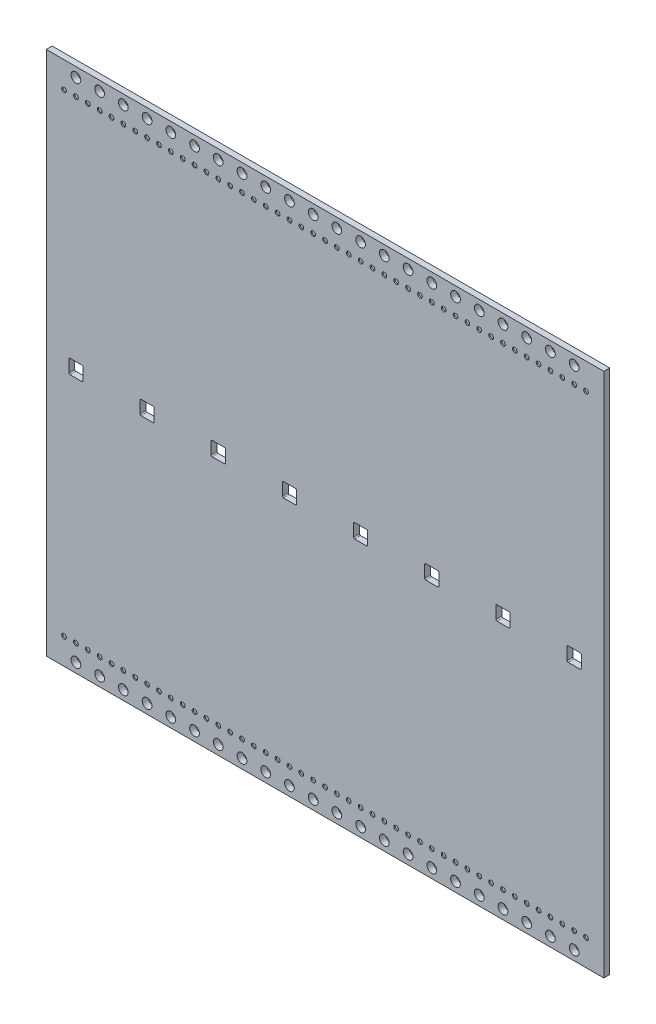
SolidWorks part; units mm, degrees
ref_plane "前视基准面" through (0, 0, 0) normal (0, 0, 1) x (1, 0, 0)
ref_plane "上视基准面" through (0, 0, 0) normal (0, 1, 0) x (1, 0, 0)
ref_plane "右视基准面" through (0, 0, 0) normal (1, 0, 0) x (0, 0, -1)
sketch "草图1" plane through (0, 0, 0) normal (0, 0, 1) x (1, 0, 0)
  line L0 (-117.5, 110.725) -> (117.5, 110.725)
  line L1 (117.5, -110.725) -> (-117.5, -110.725)
  line L2 (-117.5, -110.725) -> (-117.5, 110.725)
  line L3 (117.5, 110.725) -> (117.5, -110.725)
  line L4 (117.5, 110.725) -> (-117.5, -110.725) construction
  circle A0 centre (-105, 106.725) radius 2.05
  circle A1 centre (-95, 106.725) radius 2.05
  circle A2 centre (-95, -106.725) radius 2.05
  circle A3 centre (-85, 106.725) radius 2.05
  circle A4 centre (-85, -106.725) radius 2.05
  circle A5 centre (-75, 106.725) radius 2.05
  circle A6 centre (-75, -106.725) radius 2.05
  circle A7 centre (-65, 106.725) radius 2.05
  circle A8 centre (-65, -106.725) radius 2.05
  circle A9 centre (-55, 106.725) radius 2.05
  circle A10 centre (-55, -106.725) radius 2.05
  circle A11 centre (-45, 106.725) radius 2.05
  circle A12 centre (-45, -106.725) radius 2.05
  circle A13 centre (-35, 106.725) radius 2.05
  circle A14 centre (-35, -106.725) radius 2.05
  circle A15 centre (-25, 106.725) radius 2.05
  circle A16 centre (-25, -106.725) radius 2.05
  circle A17 centre (-15, 106.725) radius 2.05
  circle A18 centre (-15, -106.725) radius 2.05
  circle A19 centre (-5, 106.725) radius 2.05
  circle A20 centre (-5, -106.725) radius 2.05
  circle A21 centre (5, 106.725) radius 2.05
  circle A22 centre (5, -106.725) radius 2.05
  circle A23 centre (15, 106.725) radius 2.05
  circle A24 centre (15, -106.725) radius 2.05
  circle A25 centre (25, 106.725) radius 2.05
  circle A26 centre (25, -106.725) radius 2.05
  circle A27 centre (35, 106.725) radius 2.05
  circle A28 centre (35, -106.725) radius 2.05
  circle A29 centre (45, 106.725) radius 2.05
  circle A30 centre (45, -106.725) radius 2.05
  circle A31 centre (55, 106.725) radius 2.05
  circle A32 centre (55, -106.725) radius 2.05
  circle A33 centre (65, 106.725) radius 2.05
  circle A34 centre (65, -106.725) radius 2.05
  circle A35 centre (75, 106.725) radius 2.05
  circle A36 centre (75, -106.725) radius 2.05
  circle A37 centre (85, 106.725) radius 2.05
  circle A38 centre (85, -106.725) radius 2.05
  circle A39 centre (95, 106.725) radius 2.05
  circle A40 centre (95, -106.725) radius 2.05
  circle A41 centre (105, 106.725) radius 2.05
  circle A42 centre (105, -106.725) radius 2.05
  circle A52 centre (-105, -106.725) radius 2.05
extrude "凸台-拉伸1" add sketch "草图1" along normal mid plane 2.5
sketch "草图2" plane through (0, 0, 1.25) normal (0, 0, 1) x (1, 0, 0)
  line L0 (117.5, 110.725) -> (-117.5, 110.725) construction
  line L1 (-117.5, -110.725) -> (117.5, -110.725) construction
  circle A0 centre (-110, 99.725) radius 1
  circle A2 centre (-105, 106.725) radius 2.05 construction
  circle A3 centre (-110, -99.725) radius 1
  circle A4 centre (-105, 99.725) radius 1
  circle A5 centre (-105, -99.725) radius 1
  circle A6 centre (-100, 99.725) radius 1
  circle A7 centre (-100, -99.725) radius 1
  circle A8 centre (-95, 99.725) radius 1
  circle A9 centre (-95, -99.725) radius 1
  circle A10 centre (-90, 99.725) radius 1
  circle A11 centre (-90, -99.725) radius 1
  circle A12 centre (-85, 99.725) radius 1
  circle A13 centre (-85, -99.725) radius 1
  circle A14 centre (-80, 99.725) radius 1
  circle A15 centre (-80, -99.725) radius 1
  circle A16 centre (-75, 99.725) radius 1
  circle A17 centre (-75, -99.725) radius 1
  circle A18 centre (-70, 99.725) radius 1
  circle A19 centre (-70, -99.725) radius 1
  circle A20 centre (-65, 99.725) radius 1
  circle A21 centre (-65, -99.725) radius 1
  circle A22 centre (-60, 99.725) radius 1
  circle A23 centre (-60, -99.725) radius 1
  circle A24 centre (-55, 99.725) radius 1
  circle A25 centre (-55, -99.725) radius 1
  circle A26 centre (-50, 99.725) radius 1
  circle A27 centre (-50, -99.725) radius 1
  circle A28 centre (-45, 99.725) radius 1
  circle A29 centre (-45, -99.725) radius 1
  circle A30 centre (-40, 99.725) radius 1
  circle A31 centre (-40, -99.725) radius 1
  circle A32 centre (-35, 99.725) radius 1
  circle A33 centre (-35, -99.725) radius 1
  circle A34 centre (-30, 99.725) radius 1
  circle A35 centre (-30, -99.725) radius 1
  circle A36 centre (-25, 99.725) radius 1
  circle A37 centre (-25, -99.725) radius 1
  circle A38 centre (-20, 99.725) radius 1
  circle A39 centre (-20, -99.725) radius 1
  circle A40 centre (-15, 99.725) radius 1
  circle A41 centre (-15, -99.725) radius 1
  circle A42 centre (-10, 99.725) radius 1
  circle A43 centre (-10, -99.725) radius 1
  circle A44 centre (-5, 99.725) radius 1
  circle A45 centre (-5, -99.725) radius 1
  circle A46 centre (0, 99.725) radius 1
  circle A47 centre (0, -99.725) radius 1
  circle A48 centre (5, 99.725) radius 1
  circle A49 centre (5, -99.725) radius 1
  circle A50 centre (10, 99.725) radius 1
  circle A51 centre (10, -99.725) radius 1
  circle A52 centre (15, 99.725) radius 1
  circle A53 centre (15, -99.725) radius 1
  circle A54 centre (20, 99.725) radius 1
  circle A55 centre (20, -99.725) radius 1
  circle A56 centre (25, 99.725) radius 1
  circle A57 centre (25, -99.725) radius 1
  circle A58 centre (30, 99.725) radius 1
  circle A59 centre (30, -99.725) radius 1
  circle A60 centre (35, 99.725) radius 1
  circle A61 centre (35, -99.725) radius 1
  circle A62 centre (40, 99.725) radius 1
  circle A63 centre (40, -99.725) radius 1
  circle A64 centre (45, 99.725) radius 1
  circle A65 centre (45, -99.725) radius 1
  circle A66 centre (50, 99.725) radius 1
  circle A67 centre (50, -99.725) radius 1
  circle A68 centre (55, 99.725) radius 1
  circle A69 centre (55, -99.725) radius 1
  circle A70 centre (60, 99.725) radius 1
  circle A71 centre (60, -99.725) radius 1
  circle A72 centre (65, 99.725) radius 1
  circle A73 centre (65, -99.725) radius 1
  circle A74 centre (70, 99.725) radius 1
  circle A75 centre (70, -99.725) radius 1
  circle A76 centre (75, 99.725) radius 1
  circle A77 centre (75, -99.725) radius 1
  circle A78 centre (80, 99.725) radius 1
  circle A79 centre (80, -99.725) radius 1
  circle A80 centre (85, 99.725) radius 1
  circle A81 centre (85, -99.725) radius 1
  circle A82 centre (90, 99.725) radius 1
  circle A83 centre (90, -99.725) radius 1
  circle A84 centre (95, 99.725) radius 1
  circle A85 centre (95, -99.725) radius 1
  circle A86 centre (100, 99.725) radius 1
  circle A87 centre (100, -99.725) radius 1
  circle A88 centre (105, 99.725) radius 1
  circle A89 centre (105, -99.725) radius 1
  circle A90 centre (110, 99.725) radius 1
  circle A91 centre (110, -99.725) radius 1
extrude "切除-拉伸1" cut sketch "草图2" against normal blind 0.5
sketch "草图3" plane through (0, 0, -1.25) normal (0, 0, -1) x (-1, 0, 0)
  circle A0 centre (110, 99.725) radius 1
  circle A1 centre (110, -99.725) radius 1
  circle A2 centre (105, 99.725) radius 1
  circle A3 centre (105, -99.725) radius 1
  circle A4 centre (100, 99.725) radius 1
  circle A5 centre (100, -99.725) radius 1
  circle A6 centre (95, 99.725) radius 1
  circle A7 centre (95, -99.725) radius 1
  circle A8 centre (90, 99.725) radius 1
  circle A9 centre (90, -99.725) radius 1
  circle A10 centre (85, 99.725) radius 1
  circle A11 centre (85, -99.725) radius 1
  circle A12 centre (80, 99.725) radius 1
  circle A13 centre (80, -99.725) radius 1
  circle A14 centre (75, 99.725) radius 1
  circle A15 centre (75, -99.725) radius 1
  circle A16 centre (70, 99.725) radius 1
  circle A17 centre (70, -99.725) radius 1
  circle A18 centre (65, 99.725) radius 1
  circle A19 centre (65, -99.725) radius 1
  circle A20 centre (60, 99.725) radius 1
  circle A21 centre (60, -99.725) radius 1
  circle A22 centre (55, 99.725) radius 1
  circle A23 centre (55, -99.725) radius 1
  circle A24 centre (50, 99.725) radius 1
  circle A25 centre (50, -99.725) radius 1
  circle A26 centre (45, 99.725) radius 1
  circle A27 centre (45, -99.725) radius 1
  circle A28 centre (40, 99.725) radius 1
  circle A29 centre (40, -99.725) radius 1
  circle A30 centre (35, 99.725) radius 1
  circle A31 centre (35, -99.725) radius 1
  circle A32 centre (30, 99.725) radius 1
  circle A33 centre (30, -99.725) radius 1
  circle A34 centre (25, 99.725) radius 1
  circle A35 centre (25, -99.725) radius 1
  circle A36 centre (20, 99.725) radius 1
  circle A37 centre (20, -99.725) radius 1
  circle A38 centre (15, 99.725) radius 1
  circle A39 centre (15, -99.725) radius 1
  circle A40 centre (10, 99.725) radius 1
  circle A41 centre (10, -99.725) radius 1
  circle A42 centre (5, 99.725) radius 1
  circle A43 centre (5, -99.725) radius 1
  circle A44 centre (0, 99.725) radius 1
  circle A45 centre (0, -99.725) radius 1
  circle A46 centre (-5, 99.725) radius 1
  circle A47 centre (-5, -99.725) radius 1
  circle A48 centre (-10, 99.725) radius 1
  circle A49 centre (-10, -99.725) radius 1
  circle A50 centre (-15, 99.725) radius 1
  circle A51 centre (-15, -99.725) radius 1
  circle A52 centre (-20, 99.725) radius 1
  circle A53 centre (-20, -99.725) radius 1
  circle A54 centre (-25, 99.725) radius 1
  circle A55 centre (-25, -99.725) radius 1
  circle A56 centre (-30, 99.725) radius 1
  circle A57 centre (-30, -99.725) radius 1
  circle A58 centre (-35, 99.725) radius 1
  circle A59 centre (-35, -99.725) radius 1
  circle A60 centre (-40, 99.725) radius 1
  circle A61 centre (-40, -99.725) radius 1
  circle A62 centre (-45, 99.725) radius 1
  circle A63 centre (-45, -99.725) radius 1
  circle A64 centre (-50, 99.725) radius 1
  circle A65 centre (-50, -99.725) radius 1
  circle A66 centre (-55, 99.725) radius 1
  circle A67 centre (-55, -99.725) radius 1
  circle A68 centre (-60, 99.725) radius 1
  circle A69 centre (-60, -99.725) radius 1
  circle A70 centre (-65, 99.725) radius 1
  circle A71 centre (-65, -99.725) radius 1
  circle A72 centre (-70, 99.725) radius 1
  circle A73 centre (-70, -99.725) radius 1
  circle A74 centre (-75, 99.725) radius 1
  circle A75 centre (-75, -99.725) radius 1
  circle A76 centre (-80, 99.725) radius 1
  circle A77 centre (-80, -99.725) radius 1
  circle A78 centre (-85, 99.725) radius 1
  circle A79 centre (-85, -99.725) radius 1
  circle A80 centre (-90, 99.725) radius 1
  circle A81 centre (-90, -99.725) radius 1
  circle A82 centre (-95, 99.725) radius 1
  circle A83 centre (-95, -99.725) radius 1
  circle A84 centre (-100, 99.725) radius 1
  circle A85 centre (-100, -99.725) radius 1
  circle A86 centre (-105, 99.725) radius 1
  circle A87 centre (-105, -99.725) radius 1
  circle A88 centre (-110, 99.725) radius 1
  circle A89 centre (-110, -99.725) radius 1
extrude "凸台-拉伸2" add sketch "草图3" along normal blind 1
sketch "草图4" plane through (0, 0, 1.25) normal (0, 0, 1) x (1, 0, 0)
  line L0 (-117.5, 110.725) -> (-117.5, -110.725) construction
  line L1 (-107.5, -3) -> (-102.5, -3)
  line L2 (-108, -2.5) -> (-108, 2.5)
  line L3 (-107.5, 3) -> (-102.5, 3)
  line L4 (-102, -2.5) -> (-102, 2.5)
  line L5 (-108, -3) -> (-102, 3) construction
  line L6 (-108, 3) -> (-102, -3) construction
  line L8 (117.5, 110.725) -> (-117.5, 110.725) construction
  line L9 (-117.5, -110.725) -> (117.5, -110.725) construction
  line L10 (-77.5, 3) -> (-72.5, 3)
  line L11 (-78, -2.5) -> (-78, 2.5)
  line L12 (-77.5, -3) -> (-72.5, -3)
  line L13 (-72, -2.5) -> (-72, 2.5)
  line L14 (-47.5, 3) -> (-42.5, 3)
  line L15 (-48, -2.5) -> (-48, 2.5)
  line L16 (-47.5, -3) -> (-42.5, -3)
  line L17 (-42, -2.5) -> (-42, 2.5)
  line L18 (-17.5, 3) -> (-12.5, 3)
  line L19 (-18, -2.5) -> (-18, 2.5)
  line L20 (-17.5, -3) -> (-12.5, -3)
  line L21 (-12, -2.5) -> (-12, 2.5)
  line L22 (12.5, 3) -> (17.5, 3)
  line L23 (12, -2.5) -> (12, 2.5)
  line L24 (12.5, -3) -> (17.5, -3)
  line L25 (18, -2.5) -> (18, 2.5)
  line L26 (42.5, 3) -> (47.5, 3)
  line L27 (42, -2.5) -> (42, 2.5)
  line L28 (42.5, -3) -> (47.5, -3)
  line L29 (48, -2.5) -> (48, 2.5)
  line L30 (72.5, 3) -> (77.5, 3)
  line L31 (72, -2.5) -> (72, 2.5)
  line L32 (72.5, -3) -> (77.5, -3)
  line L33 (78, -2.5) -> (78, 2.5)
  line L34 (102.5, 3) -> (107.5, 3)
  line L35 (102, -2.5) -> (102, 2.5)
  line L36 (102.5, -3) -> (107.5, -3)
  line L37 (108, -2.5) -> (108, 2.5)
  arc A0 (-107.5, 3) -> (-108, 2.5) centre (-107.5, 2.5) ccw
  arc A1 (-108, -2.5) -> (-107.5, -3) centre (-107.5, -2.5) ccw
  arc A2 (-102.5, -3) -> (-102, -2.5) centre (-102.5, -2.5) ccw
  arc A3 (-102, 2.5) -> (-102.5, 3) centre (-102.5, 2.5) ccw
  arc A4 (-77.5, 3) -> (-78, 2.5) centre (-77.5, 2.5) ccw
  arc A5 (-78, -2.5) -> (-77.5, -3) centre (-77.5, -2.5) ccw
  arc A6 (-72.5, -3) -> (-72, -2.5) centre (-72.5, -2.5) ccw
  arc A7 (-72, 2.5) -> (-72.5, 3) centre (-72.5, 2.5) ccw
  arc A8 (-47.5, 3) -> (-48, 2.5) centre (-47.5, 2.5) ccw
  arc A9 (-48, -2.5) -> (-47.5, -3) centre (-47.5, -2.5) ccw
  arc A10 (-42.5, -3) -> (-42, -2.5) centre (-42.5, -2.5) ccw
  arc A11 (-42, 2.5) -> (-42.5, 3) centre (-42.5, 2.5) ccw
  arc A12 (-17.5, 3) -> (-18, 2.5) centre (-17.5, 2.5) ccw
  arc A13 (-18, -2.5) -> (-17.5, -3) centre (-17.5, -2.5) ccw
  arc A14 (-12.5, -3) -> (-12, -2.5) centre (-12.5, -2.5) ccw
  arc A15 (-12, 2.5) -> (-12.5, 3) centre (-12.5, 2.5) ccw
  arc A16 (12.5, 3) -> (12, 2.5) centre (12.5, 2.5) ccw
  arc A17 (12, -2.5) -> (12.5, -3) centre (12.5, -2.5) ccw
  arc A18 (17.5, -3) -> (18, -2.5) centre (17.5, -2.5) ccw
  arc A19 (18, 2.5) -> (17.5, 3) centre (17.5, 2.5) ccw
  arc A20 (42.5, 3) -> (42, 2.5) centre (42.5, 2.5) ccw
  arc A21 (42, -2.5) -> (42.5, -3) centre (42.5, -2.5) ccw
  arc A22 (47.5, -3) -> (48, -2.5) centre (47.5, -2.5) ccw
  arc A23 (48, 2.5) -> (47.5, 3) centre (47.5, 2.5) ccw
  arc A24 (72.5, 3) -> (72, 2.5) centre (72.5, 2.5) ccw
  arc A25 (72, -2.5) -> (72.5, -3) centre (72.5, -2.5) ccw
  arc A26 (77.5, -3) -> (78, -2.5) centre (77.5, -2.5) ccw
  arc A27 (78, 2.5) -> (77.5, 3) centre (77.5, 2.5) ccw
  arc A28 (102.5, 3) -> (102, 2.5) centre (102.5, 2.5) ccw
  arc A29 (102, -2.5) -> (102.5, -3) centre (102.5, -2.5) ccw
  arc A30 (107.5, -3) -> (108, -2.5) centre (107.5, -2.5) ccw
  arc A31 (108, 2.5) -> (107.5, 3) centre (107.5, 2.5) ccw
  point P0 (-105, 0)
  dimension "D6" = 0.5
  dimension "D1" = 9.5
  dimension "D2" = 6
  dimension "D3" = 6
  dimension "D4" = 110.725
  dimension "D5" = 110.725
  dimension "D7" = 8
extrude "切除-拉伸2" cut sketch "草图4" against normal blind 10
equation "\"D4@草图1\"=\"D1@草图1\"/2"
equation "\"D3@草图1\"=\"D2@草图1\"/2"
equation "\"D9@草图1\"=\"D1@草图1\"/10-2"
equation "\"D5@草图2\"=\"D1@草图1\"/5-2"
equation "\"D1@草图3\"=\"D1@草图1\"/5-2"
